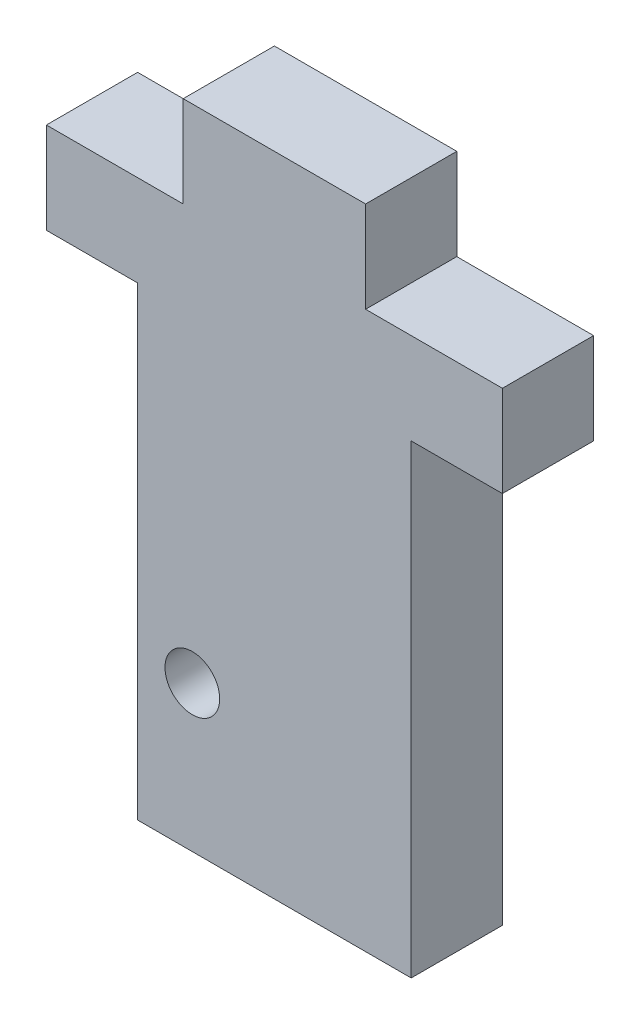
SolidWorks part; units mm, degrees
ref_plane "Plan de face" through (0, 0, 0) normal (0, 0, 1) x (1, 0, 0)
ref_plane "Plan de dessus" through (0, 0, 0) normal (0, 1, 0) x (1, 0, 0)
ref_plane "Plan de droite" through (0, 0, 0) normal (1, 0, 0) x (0, 0, -1)
sketch "Esquisse1" plane through (0, 0, 0) normal (0, 0, 1) x (1, 0, 0)
  line L1 (-12.5, 17.75) -> (12.5, 17.75)
  line L2 (-12.5, 17.75) -> (-12.5, -17.75)
  line L3 (-12.5, -17.75) -> (12.5, -17.75)
  line L4 (12.5, 17.75) -> (12.5, -17.75)
  line L5 (-12.5, 17.75) -> (12.5, -17.75) construction
  line L6 (-12.5, -17.75) -> (12.5, 17.75) construction
  point P0 (0, 0)
  dimension "D1" = 25
  dimension "D2" = 35.5
extrude "Boss.-Extru.1" add sketch "Esquisse1" along normal blind 5
sketch "Esquisse2" plane through (0, 0, 5) normal (0, 0, 1) x (1, 0, 0)
  line L1 (-12.5, 17.75) -> (-5, 17.75)
  line L2 (-12.5, 17.75) -> (-12.5, 12.75)
  line L3 (-12.5, 12.75) -> (-5, 12.75)
  line L4 (-5, 17.75) -> (-5, 12.75)
  line L5 (12.5, 17.75) -> (5, 17.75)
  line L6 (12.5, 17.75) -> (12.5, 12.75)
  line L7 (12.5, 12.75) -> (5, 12.75)
  line L8 (5, 17.75) -> (5, 12.75)
  dimension "D1" = 5
  dimension "D2" = 10
extrude "Enlèv. mat.-Extru.1" cut sketch "Esquisse2" against normal up to next
sketch "Esquisse3" plane through (0, 0, 5) normal (0, 0, 1) x (1, 0, 0)
  line L1 (-12.5, 7.75) -> (-7.5, 7.75)
  line L2 (-12.5, 7.75) -> (-12.5, -17.75)
  line L3 (-12.5, -17.75) -> (-7.5, -17.75)
  line L4 (-7.5, 7.75) -> (-7.5, -17.75)
  line L5 (12.5, 7.75) -> (7.5, 7.75)
  line L6 (12.5, 7.75) -> (12.5, -17.75)
  line L7 (12.5, -17.75) -> (7.5, -17.75)
  line L8 (7.5, 7.75) -> (7.5, -17.75)
  line L9 (-5, 12.75) -> (-5, 17.75) construction
  line L10 (12.5, -17.75) -> (12.5, 12.75) construction
  line L11 (-12.5, 12.75) -> (-5, 12.75) construction
  dimension "D1" = 5
extrude "Enlèv. mat.-Extru.2" cut sketch "Esquisse3" against normal up to next
sketch "Esquisse4" plane through (0, 0, 5) normal (0, 0, 1) x (1, 0, 0)
  line L0 (7.5, 7.75) -> (7.5, -17.75) construction
  line L3 (-7.5, -17.75) -> (7.5, -17.75) construction
  circle A0 centre (-4.5, -9.75) radius 1.5
  dimension "D2" = 3
  dimension "D3" = 8
  dimension "D1" = 12
extrude "Enlèv. mat.-Extru.3" cut sketch "Esquisse4" against normal up to next
